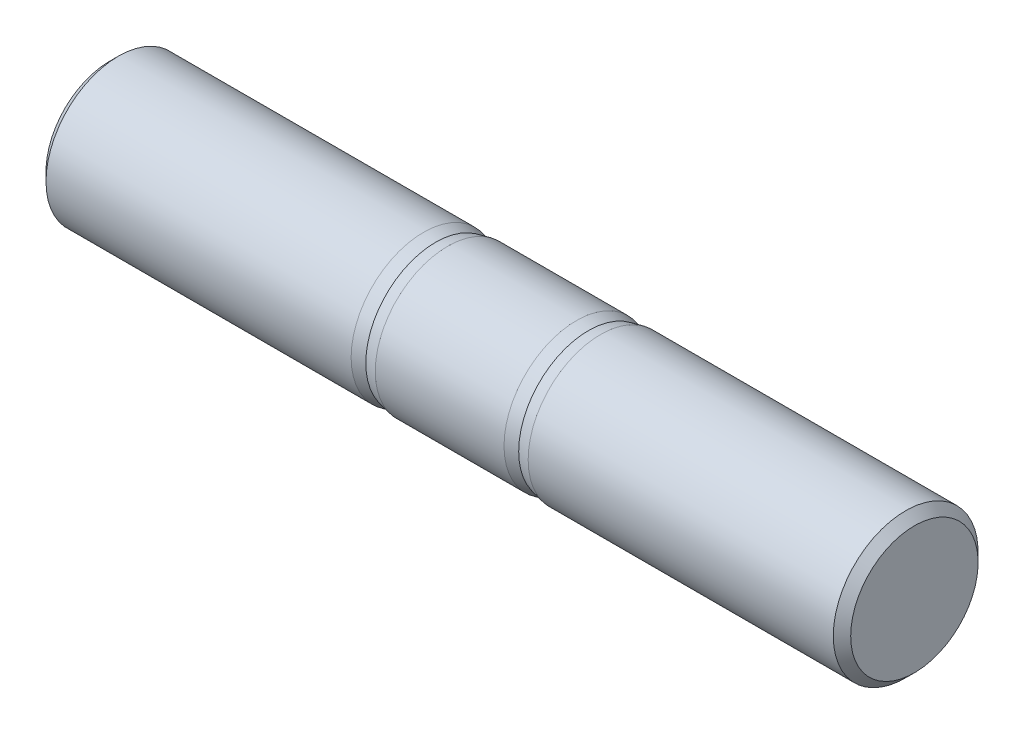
SolidWorks part; units mm, degrees
ref_plane "Front" through (0, 0, 0) normal (0, 0, 1) x (1, 0, 0)
ref_plane "Top" through (0, 0, 0) normal (0, 1, 0) x (1, 0, 0)
ref_plane "Right" through (0, 0, 0) normal (1, 0, 0) x (0, 0, -1)
sketch "Sketch1" plane through (0, 0, 0) normal (0, 0, 1) x (1, 0, 0)
  line L0 (-1.3108, 0) -> (30.3862, 0) construction
  line L1 (0, 0) -> (0, 18)
  line L2 (0, 18) -> (78, 18)
  line L3 (78, 18) -> (84, 16.701)
  line L4 (84, 16.701) -> (116, 16.701)
  line L5 (116, 16.701) -> (122, 18)
  line L6 (122, 18) -> (200, 18)
  line L7 (200, 18) -> (200, 0)
  line L8 (200, 0) -> (0, 0)
  dimension "D1" = 78
  dimension "X" = 6
  dimension "D2" = 6
  dimension "b" = 78
  dimension "l" = 200
  dimension "d" = 36
  dimension "ds" = 33.402
revolve "Base" add sketch "Sketch1" angle 360 about L0
chamfer "HeadChamfer" distance 2.165 angle 45 2 edges at (0, 0, 18) (200, 0, 18)
sketch "Sketch4" plane through (0, 0, 0) normal (0, 0, 1) x (1, 0, 0)
  line L0 (78, 16.701) -> (84, 18)
  line L1 (78, 18) -> (78, -18) construction
  line L2 (84, 18) -> (116, 18)
  line L3 (116, 18) -> (122, 16.701)
  line L4 (122, 18) -> (122, -18) construction
  line L5 (122, 16.701) -> (78, 16.701)
  line L6 (-7.8091, 0) -> (106.8365, 0) construction
  line L8 (84, 33.6577) -> (84, 2.3423) construction
  line L10 (84, 16.701) -> (84, -16.701) construction
  line L11 (84, 16.701) -> (116, 16.701) construction
revolve "BaseBody" add sketch "Sketch4" angle 360 about L6
sketch "Sketch2" plane through (0, 0, 0) normal (0, 0, 1) x (1, 0, 0)
  line L0 (197.835, 16.1251) -> (198.9175, 18)
  line L1 (198.9175, 18) -> (198.9175, 18.5)
  line L2 (198.9175, 18.5) -> (196.7525, 18.5)
  line L3 (196.7525, 18.5) -> (196.7525, 18)
  line L4 (196.7525, 18) -> (197.835, 16.1251)
  line L5 (0, 0) -> (114.8799, 0) construction
  line L6 (197.835, 18) -> (197.835, -18) construction
  dimension "D1" = 60
  dimension "D2" = 60
  dimension "D3" = 0.5
  dimension "D4" = 2.165
  dimension "D5" = 36
revolve "Cut-Revolve10" [suppressed] cut sketch "Sketch2" angle 360 about L5
pattern_linear "LPattern10" [suppressed] count 30 spacing 2.598 along (1, 0, 0)
sketch "Sketch3" plane through (0, 0, 0) normal (0, 0, 1) x (1, 0, 0)
  line L0 (2.165, 16.1251) -> (3.2475, 18)
  line L1 (3.2475, 18) -> (3.2475, 18.5)
  line L2 (3.2475, 18.5) -> (1.0825, 18.5)
  line L3 (1.0825, 18.5) -> (1.0825, 18)
  line L4 (1.0825, 18) -> (2.165, 16.1251)
  line L5 (0, 0) -> (15.3216, 0) construction
  line L6 (0, 15.835) -> (0, -15.835) construction
  line L7 (2.165, 18) -> (2.165, -18) construction
  dimension "D1" = 60
  dimension "D2" = 60
  dimension "D3" = 36
  dimension "D4" = 0.5
  dimension "D5" = 2.165
revolve "Cut-Revolve11" [suppressed] cut sketch "Sketch3" angle 360 about L5
pattern_linear "LPattern11" [suppressed] count 30 spacing 2.598 along (1, 0, 0)
equation "\"D2@Sketch1\" = \"X@Sketch1\""
equation "\"D2@ThreadCosmetic2\" = \"D2@ThreadCosmetic1\""
equation "\"b@ThreadCosmetic2\" = \"b@Sketch1\""
equation "\"D1@HeadChamfer\" =  ( \"d@Sketch1\" - \"D2@ThreadCosmetic1\" )  / 2"
equation "\"D1@Sketch1\" = \"b@Sketch1\""
equation "\"D5@Sketch2\" = \"d@Sketch1\""
equation "\"D4@Sketch2\" =  ( \"d@Sketch1\" - \"D2@ThreadCosmetic2\" )  / 2"
equation "\"D3@LPattern10\" = \"D4@Sketch2\" * 1.2"
equation "\"D1@LPattern10\" = \"b@ThreadCosmetic2\" / \"D3@LPattern10\""
equation "\"D3@Sketch3\" = \"d@Sketch1\""
equation "\"D5@Sketch3\"  =  ( \"d@Sketch1\" - \"D2@ThreadCosmetic1\" )  / 2"
equation "\"D3@LPattern11\" = \"D5@Sketch3\" * 1.2"
equation "\"D1@LPattern11\" = \"D1@ThreadCosmetic1\" / \"D3@LPattern11\""
equation "\"D1@ThreadCosmetic1\" = \"b@Sketch1\""
